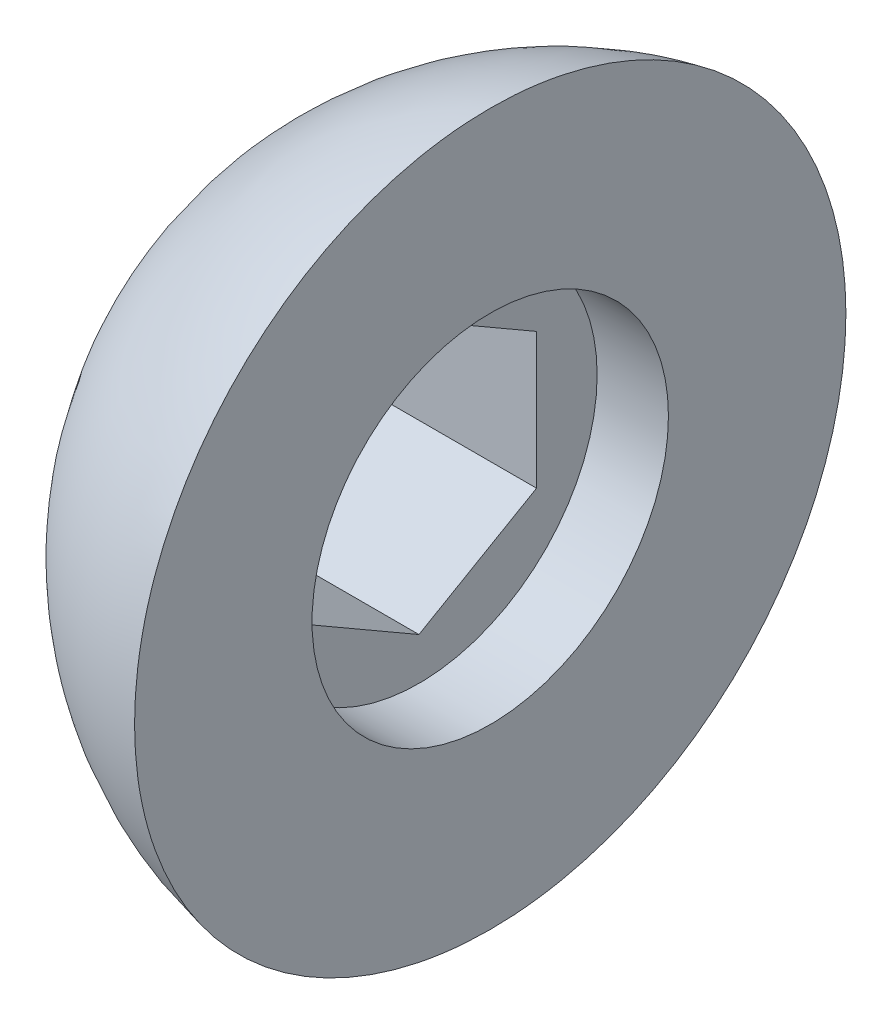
SolidWorks part; units mm, degrees
ref_plane "Plane1" through (0, 0, 0) normal (0, 0, 1) x (1, 0, 0)
ref_plane "Plane2" through (0, 0, 0) normal (0, 1, 0) x (1, 0, 0)
ref_plane "Plane3" through (0, 0, 0) normal (1, 0, 0) x (0, 0, -1)
imported_body "Imported1"
sketch "Sketch1" plane through (1.9261, 0, 0) normal (1, 0, 0) x (0, 0, -1)
  circle A0 centre (0, 0) radius 2.5
  circle A1 centre (0, 0) radius 4.9899 construction
  dimension "D1" = 5
extrude "Cut-Extrude1" cut sketch "Sketch1" against normal blind 1
